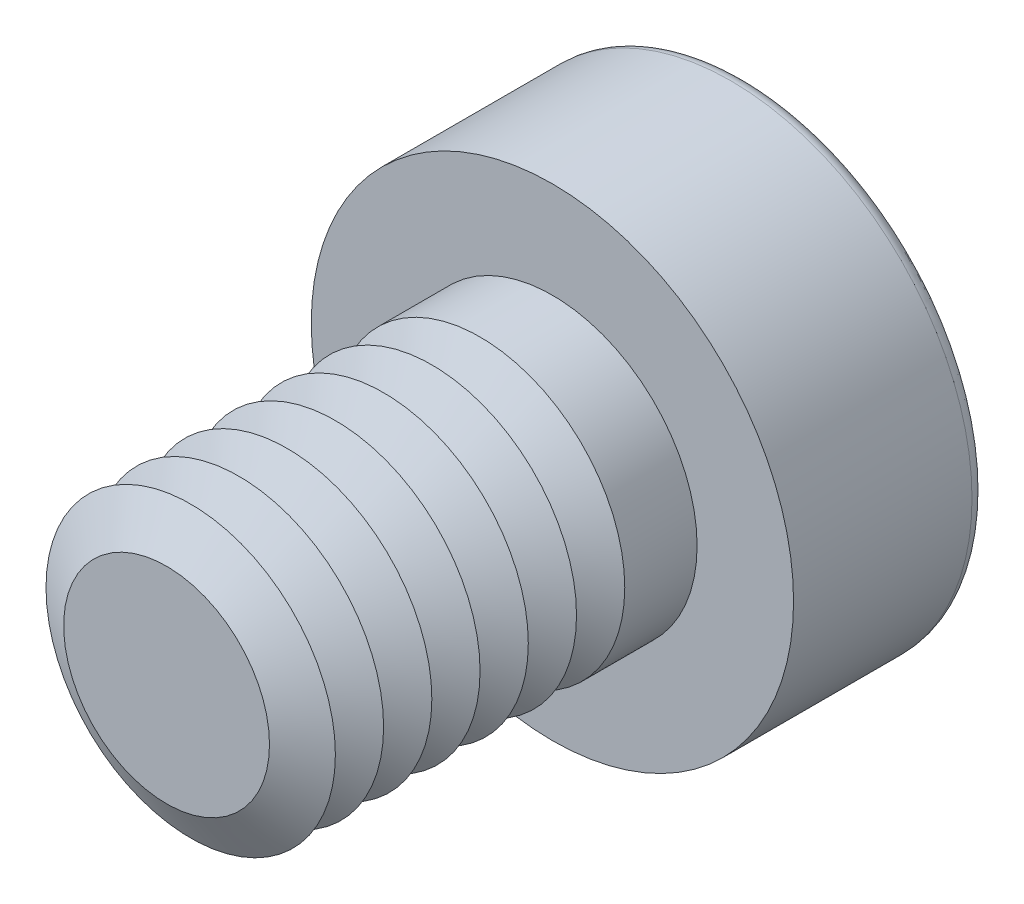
SolidWorks part; units mm, degrees
ref_plane "Front Plane" through (0, 0, 0) normal (0, 0, 1) x (1, 0, 0)
ref_plane "Top Plane" through (0, 0, 0) normal (0, 1, 0) x (1, 0, 0)
ref_plane "Right Plane" through (0, 0, 0) normal (1, 0, 0) x (0, 0, -1)
sketch "Sketch1" plane through (0, 0, 0) normal (0, 0, 1) x (1, 0, 0)
  circle A0 centre (0, 0) radius 3
  dimension "D1" = 6
extrude "Boss-Extrude1" add sketch "Sketch1" along normal blind 8
sketch "Sketch2" plane through (0, 0, 0) normal (0, 0, -1) x (-1, 0, 0)
  circle A0 centre (0, 0) radius 5
  dimension "D1" = 10
extrude "Boss-Extrude2" add sketch "Sketch2" along normal blind 4
sketch "Sketch3" plane through (0, 0, -4) normal (0, 0, -1) x (-1, 0, 0)
  line L1 (-1.1547, 2) -> (-2.3094, 0)
  line L2 (-2.3094, 0) -> (-1.1547, -2)
  line L3 (-1.1547, -2) -> (1.1547, -2)
  line L4 (1.1547, -2) -> (2.3094, 0)
  line L5 (2.3094, 0) -> (1.1547, 2)
  line L6 (1.1547, 2) -> (-1.1547, 2)
  circle A0 centre (0, 0) radius 2 construction
  dimension "D1" = 4
extrude "Cut-Extrude1" cut sketch "Sketch3" against normal blind 3
fillet "Fillet1" radius 0.3 1 edges at (-5, 0, -4)
sketch "Sketch4" plane through (0, 0, -1) normal (0, 0, -1) x (-1, 0, 0)
  line L0 (1.1547, -2) -> (2.3094, 0) construction
  circle A0 centre (0, 0) radius 2
extrude "Cut-Extrude2" cut sketch "Sketch4" against normal through all draft 60
sketch "Sketch5" plane through (0, 0, -4) normal (0, 0, -1) x (-1, 0, 0)
  circle A0 centre (0, 0) radius 2.3094
extrude "Cut-Extrude3" cut sketch "Sketch5" against normal through all draft 75
sketch "Sketch7" plane through (0, 0, 0) normal (1, 0, 0) x (0, 0, -1)
  line L25 (-8, 2.134) -> (-7.5, 3)
  line L26 (-8, 3) -> (-8, -3) construction
  line L27 (-7.5, 3) -> (-8.5, 3)
  line L28 (-8.5, 3) -> (-8, 2.134)
  line L29 (0, 3) -> (-8, 3) construction
  dimension "D1" = 1
revolve "Cut-Revolve1" cut sketch "Sketch7" angle 360 about axis through (0, 0, 8) along (0, 0, -1)
pattern_linear "LPattern1" count 7 spacing 1 along (0, 0, -1) of "Cut-Revolve1"
